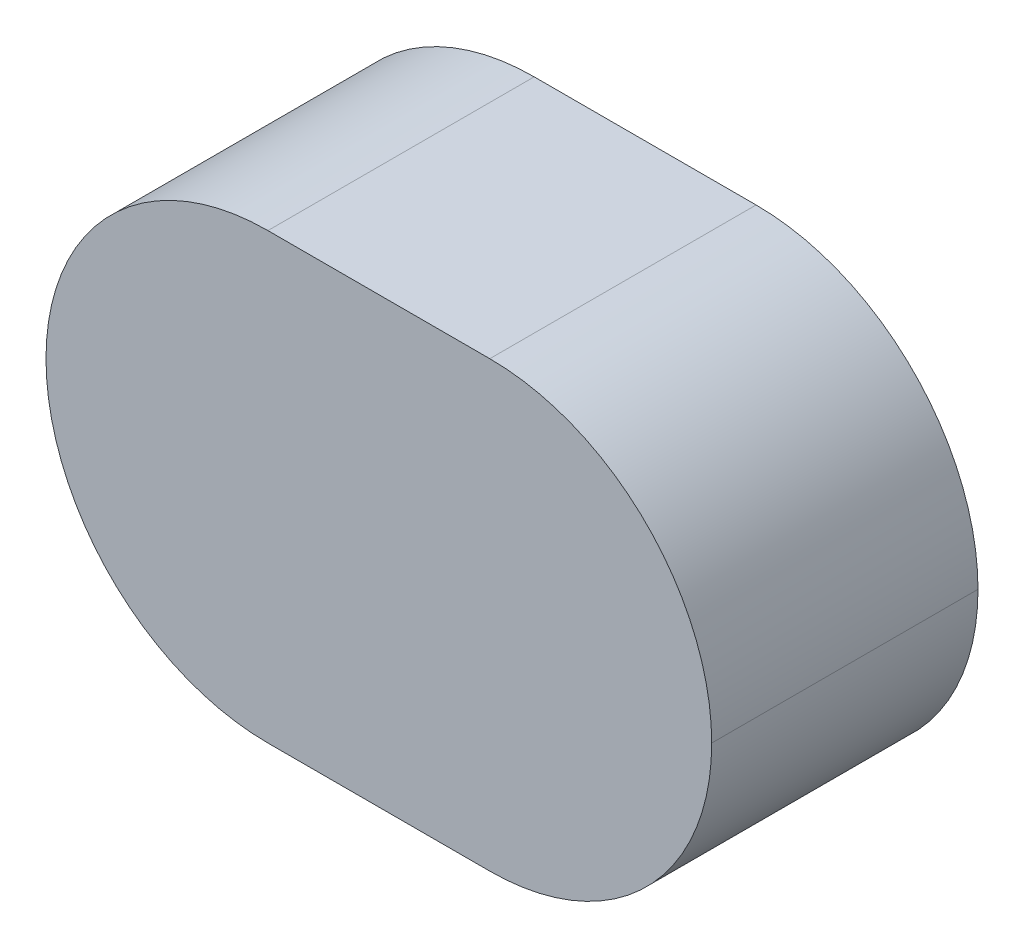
SolidWorks part; units mm, degrees
ref_plane "Спереди" through (0, 0, 0) normal (0, 0, 1) x (1, 0, 0)
ref_plane "Сверху" through (0, 0, 0) normal (0, 1, 0) x (1, 0, 0)
ref_plane "Справа" through (0, 0, 0) normal (1, 0, 0) x (0, 0, -1)
sketch "Эскиз1" plane through (0, 0, 0) normal (0, 0, 1) x (1, 0, 0)
  line L1 (7.5, -5) -> (-7.5, -5)
  line L2 (7.5, -5) -> (7.5, 5)
  line L3 (7.5, 5) -> (-7.5, 5)
  line L4 (-7.5, -5) -> (-7.5, 5)
  line L5 (7.5, -5) -> (-7.5, 5) construction
  line L6 (7.5, 5) -> (-7.5, -5) construction
  point P0 (0, 0)
  dimension "D1" = 10
  dimension "D2" = 15
extrude "Бобышка-Вытянуть1" add sketch "Эскиз1" along normal blind 6
fillet "Скругление1" radius 5 4 edges at (-7.5, -5, 3) (-7.5, 5, 3) (7.5, -5, 3) (7.5, 5, 3)
